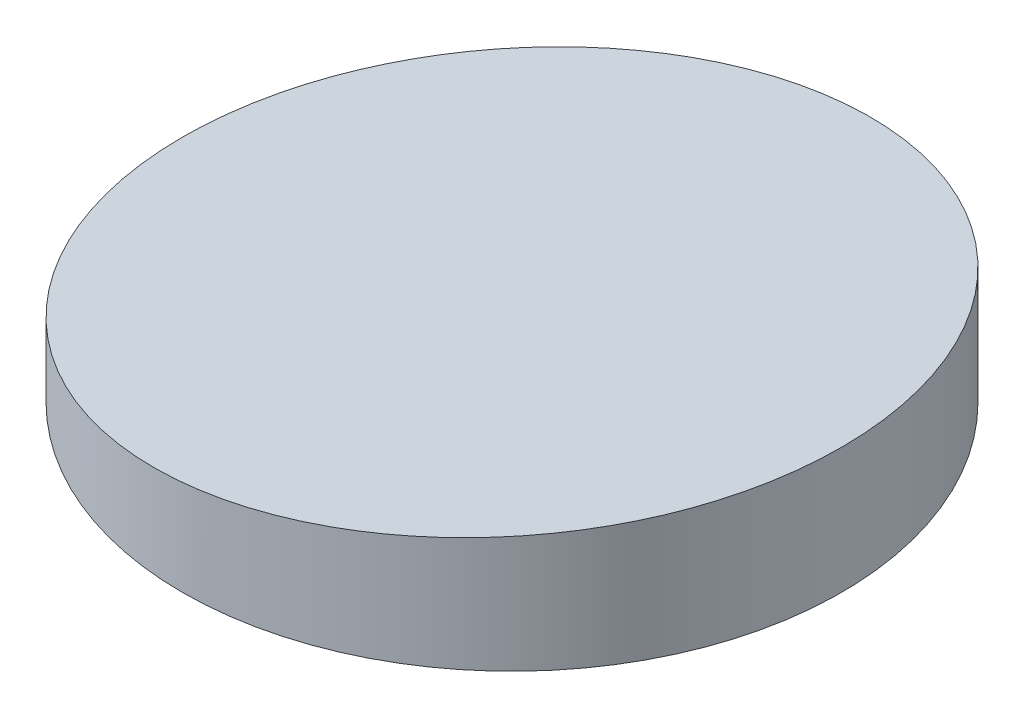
SolidWorks part; units mm, degrees
ref_plane "Front Plane" through (0, 0, 0) normal (0, 0, 1) x (1, 0, 0)
ref_plane "Top Plane" through (0, 0, 0) normal (0, 1, 0) x (1, 0, 0)
ref_plane "Right Plane" through (0, 0, 0) normal (1, 0, 0) x (0, 0, -1)
sketch "Sketch2" plane through (0, 0, 0) normal (0, 1, 0) x (1, 0, 0)
  circle A0 centre (0, 0) radius 50.8
  dimension "D1" = 101.6
extrude "Boss-Extrude1" add sketch "Sketch2" along normal blind 25.4
sketch "Sketch4" plane through (0, 0, 0) normal (0, 0, 1) x (1, 0, 0)
  line L0 (-50.8, 10) -> (50.8, 19.38)
  line L1 (-50.8, 25.4) -> (-50.8, 0) construction
  line L2 (50.8, 0) -> (50.8, 25.4) construction
  dimension "D1" = 10
extrude "Cut-Extrude1" cut sketch "Sketch4" against normal through all and the other way through all
